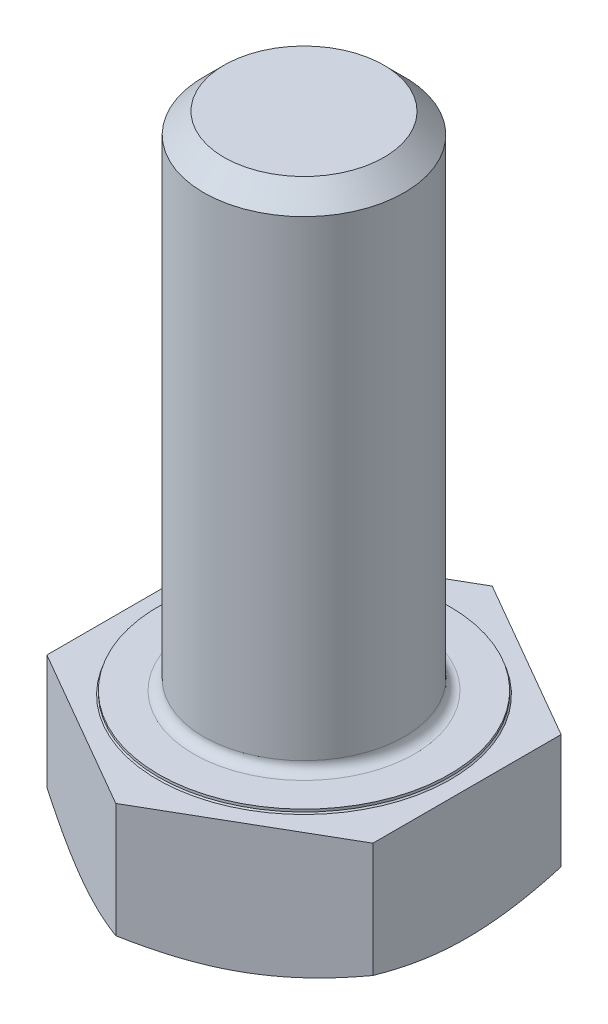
SolidWorks part; units mm, degrees
ref_plane "Plan de face" through (0, 0, 0) normal (0, 0, 1) x (1, 0, 0)
ref_plane "Plan de dessus" through (0, 0, 0) normal (0, 1, 0) x (1, 0, 0)
ref_plane "Plan de droite" through (0, 0, 0) normal (1, 0, 0) x (0, 0, -1)
imported_body "Importée3"
sketch "Esquisse1" plane through (0, -4.7194, 0) normal (0, 1, 0) x (-1, 0, 0)
  line L0 (6.5, 3.7528) -> (6.5, -3.7528)
  line L1 (6.5, -3.7528) -> (0, -7.5056)
  line L2 (0, -7.5056) -> (-6.5, -3.7528)
  line L3 (-6.5, -3.7528) -> (-6.5, 3.7528)
  line L4 (-6.5, 3.7528) -> (0, 7.5056)
  line L5 (0, 7.5056) -> (6.5, 3.7528)
extrude "Boss.-Extru.1" add sketch "Esquisse1" along normal blind 4.5694
sketch "Esquisse2" plane through (0, 0, 0) normal (0, 0, 1) x (1, 0, 0)
  line L0 (4, 20) -> (0, 20)
  line L1 (0, 20) -> (0, -0.15)
  line L2 (0, -0.15) -> (5.8, -0.15)
  line L3 (5.8, -0.15) -> (5.8, 0)
  line L4 (5.8, 0) -> (4, 0)
  line L5 (4, 0) -> (4, 20)
  line L6 (0, 20) -> (0, -0.15) construction
revolve "Révolution1" add sketch "Esquisse2" angle 360 about L6
chamfer "Chanfrein1" distance 0.8119 angle 45 1 edges at (0, 20, -4)
chamfer "Chanfrein2" distance 0.05 angle 45 1 edges at (0, -0.15, -5.8)
fillet "Congé1" radius 0.4 1 edges at (0, 0, -4)
